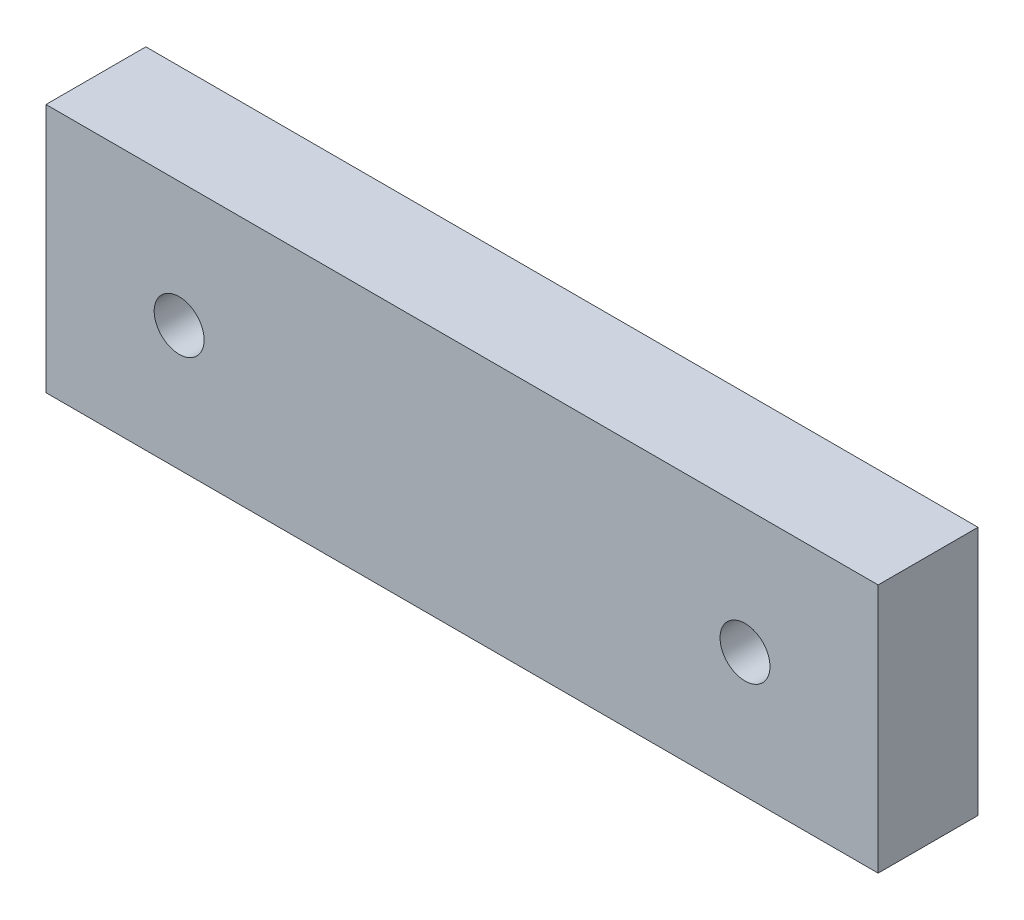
SolidWorks part; units mm, degrees
ref_plane "Plan de face" through (0, 0, 0) normal (0, 0, 1) x (1, 0, 0)
ref_plane "Plan de dessus" through (0, 0, 0) normal (0, 1, 0) x (1, 0, 0)
ref_plane "Plan de droite" through (0, 0, 0) normal (1, 0, 0) x (0, 0, -1)
sketch "Esquisse1" plane through (0, 0, 0) normal (0, 0, 1) x (1, 0, 0)
  line L1 (0, 0) -> (50, 0)
  line L2 (0, 0) -> (0, 15)
  line L3 (0, 15) -> (50, 15)
  line L4 (50, 0) -> (50, 15)
  circle A0 centre (8, 7.5) radius 1.5
  circle A1 centre (42, 7.5) radius 1.5
  dimension "D3" = 3
  dimension "D4" = 3
  dimension "D1" = 50
  dimension "D2" = 15
  dimension "D5" = 8
  dimension "D6" = 8
  dimension "D7" = 7.5
extrude "Extrusion1" add sketch "Esquisse1" along normal blind 6
